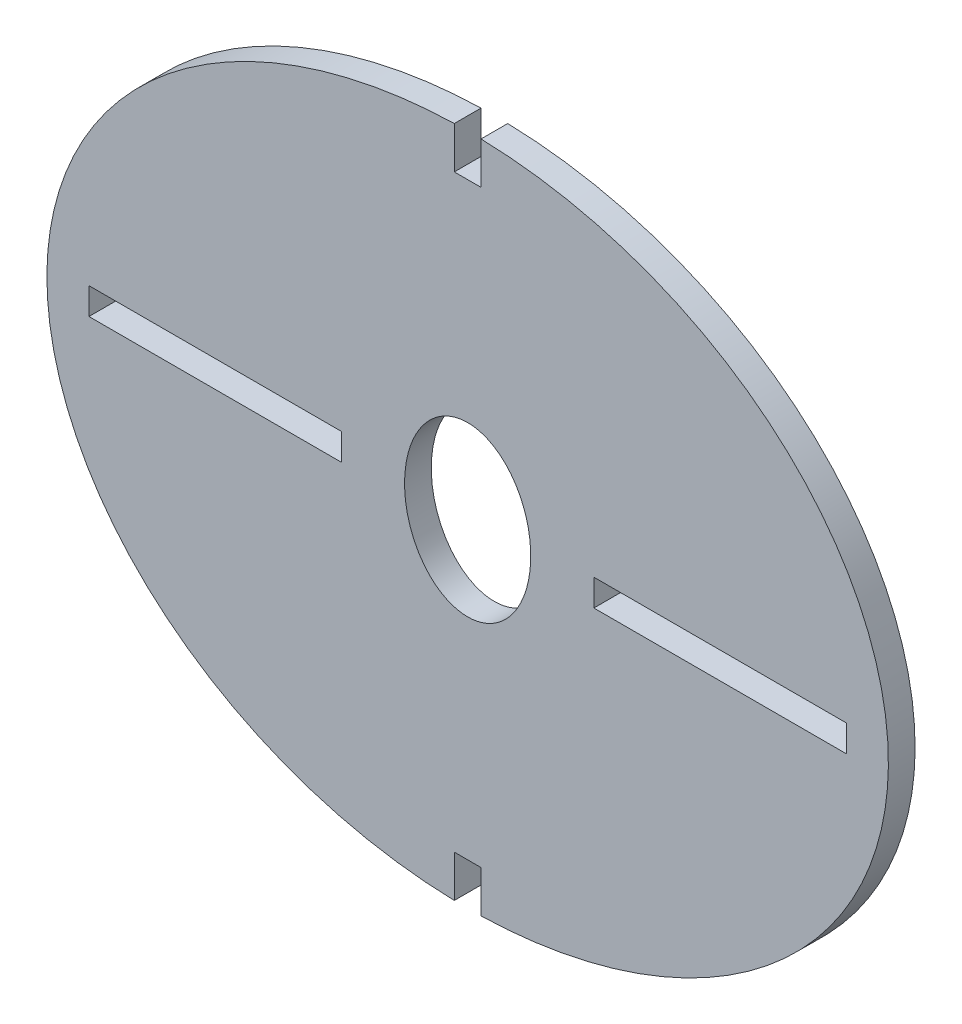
SolidWorks part; units mm, degrees
ref_plane "Front Plane" through (0, 0, 0) normal (0, 0, 1) x (1, 0, 0)
ref_plane "Top Plane" through (0, 0, 0) normal (0, 1, 0) x (1, 0, 0)
ref_plane "Right Plane" through (0, 0, 0) normal (1, 0, 0) x (0, 0, -1)
sketch "Sketch1" plane through (0, 0, 0) normal (0, 0, 1) x (1, 0, 0)
  line L2 (0, 0) -> (-15, 0) construction
  line L3 (0, 0) -> (15, 0) construction
  line L4 (-15, 1.5875) -> (-15, -1.5875)
  line L5 (-15, 1.5875) -> (-45, 1.5875)
  line L6 (-45, 1.5875) -> (-45, -1.5875)
  line L7 (-45, -1.5875) -> (-15, -1.5875)
  line L8 (45, 1.5875) -> (45, -1.5875)
  line L9 (45, -1.5875) -> (15, -1.5875)
  line L10 (15, 1.5875) -> (15, -1.5875)
  line L11 (15, 1.5875) -> (45, 1.5875)
  ellipse E0 centre (0, 0) end of major axis (-50, 0) minor radius 40
  ellipse E1 centre (0, 0) end of major axis (0, -10) minor radius 7.5
extrude "Boss-Extrude1" add sketch "Sketch1" along normal blind 3.175
sketch "Sketch2" plane through (0, 0, 3.175) normal (0, 0, 1) x (1, 0, 0)
  line L0 (0, 0) -> (0, 35) construction
  line L1 (0, 0) -> (-24.4213, 0) construction
  line L2 (0, 35) -> (-1.5875, 35)
  line L3 (-1.5875, 35) -> (-1.5875, 61.3969)
  line L4 (-1.5875, 61.3969) -> (1.5875, 61.3969)
  line L5 (1.5875, 61.3969) -> (1.5875, 35)
  line L6 (1.5875, 35) -> (0, 35)
  line L7 (-1.5875, -61.3969) -> (1.5875, -61.3969)
  line L8 (-1.5875, -35) -> (-1.5875, -61.3969)
  line L9 (1.5875, -61.3969) -> (1.5875, -35)
  line L10 (1.5875, -35) -> (0, -35)
  line L11 (0, -35) -> (-1.5875, -35)
extrude "Cut-Extrude1" cut sketch "Sketch2" against normal blind 10
